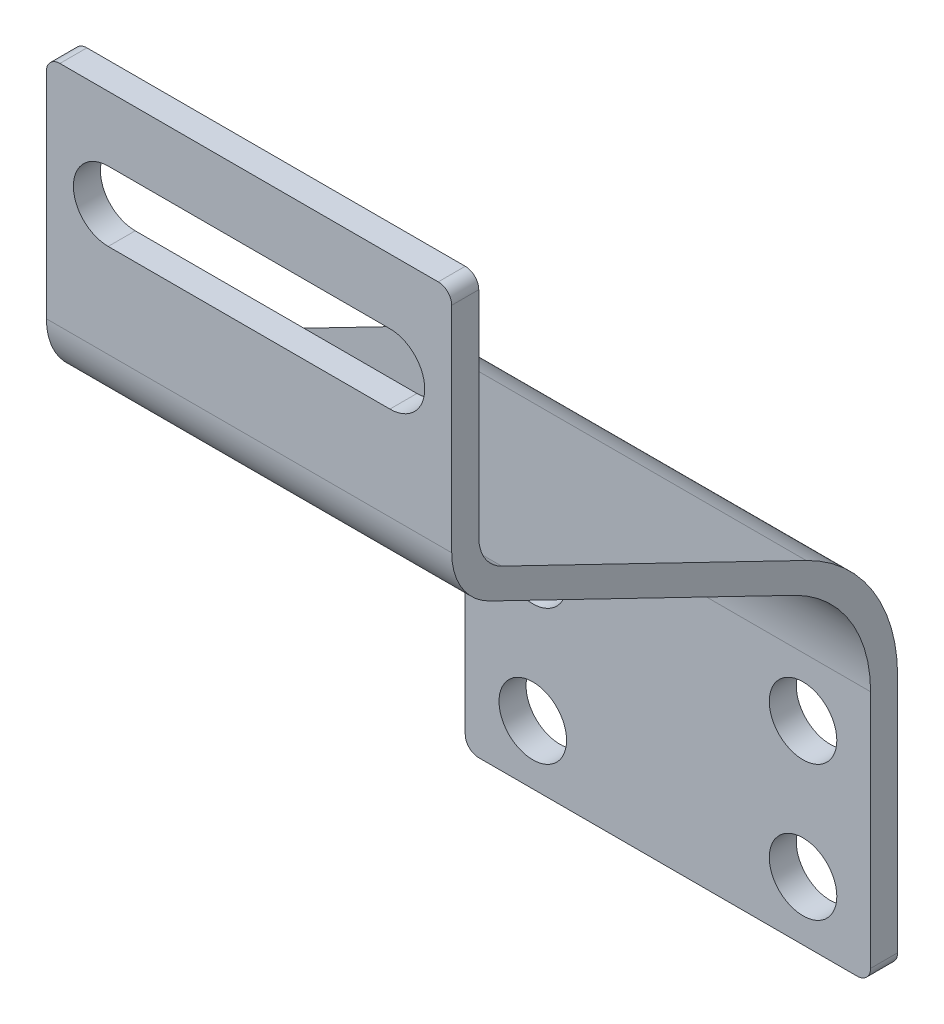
SolidWorks part; units mm, degrees
other "<Door Bracket_01>-<Fillet1>"
ref_plane "Front Plane" through (0, 0, 0) normal (0, 0, 1) x (1, 0, 0)
ref_plane "Top Plane" through (0, 0, 0) normal (0, 1, 0) x (1, 0, 0)
ref_plane "Right Plane" through (0, 0, 0) normal (1, 0, 0) x (0, 0, -1)
mirrored part "Door Bracket_01_Mirrored"
